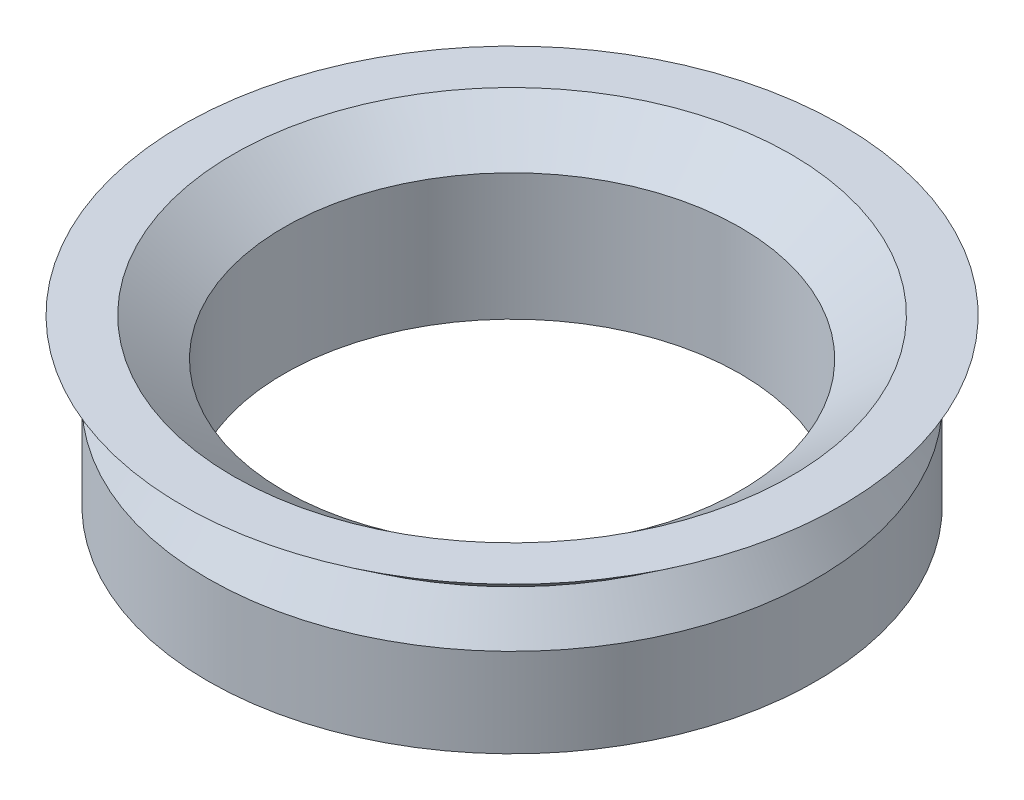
SolidWorks part; units mm, degrees
ref_plane "Face" through (0, 0, 0) normal (0, 0, 1) x (1, 0, 0)
ref_plane "Dessus" through (0, 0, 0) normal (0, 1, 0) x (1, 0, 0)
ref_plane "Droite" through (0, 0, 0) normal (1, 0, 0) x (0, 0, -1)
sketch "Esquisse1" plane through (0, 0, 0) normal (0, 0, 1) x (1, 0, 0)
  line L0 (0, -24.2489) -> (0, 43.958) construction
  line L1 (9, 5) -> (9, 0)
  line L2 (9, 0) -> (12, 0)
  line L3 (12, 0) -> (12, 3.5)
  line L4 (12, 3.5) -> (11, 5)
  line L5 (11, 5) -> (13, 6.5)
  line L6 (13, 6.5) -> (11, 6.5)
  line L7 (11, 6.5) -> (9, 5)
  dimension "D1" = 18
  dimension "D2" = 24
  dimension "D3" = 6.5
  dimension "D4" = 26
  dimension "D5" = 2
  dimension "D6" = 5
  dimension "D7" = 3.5
revolve "Révolution1" add sketch "Esquisse1" angle 360 about L0
